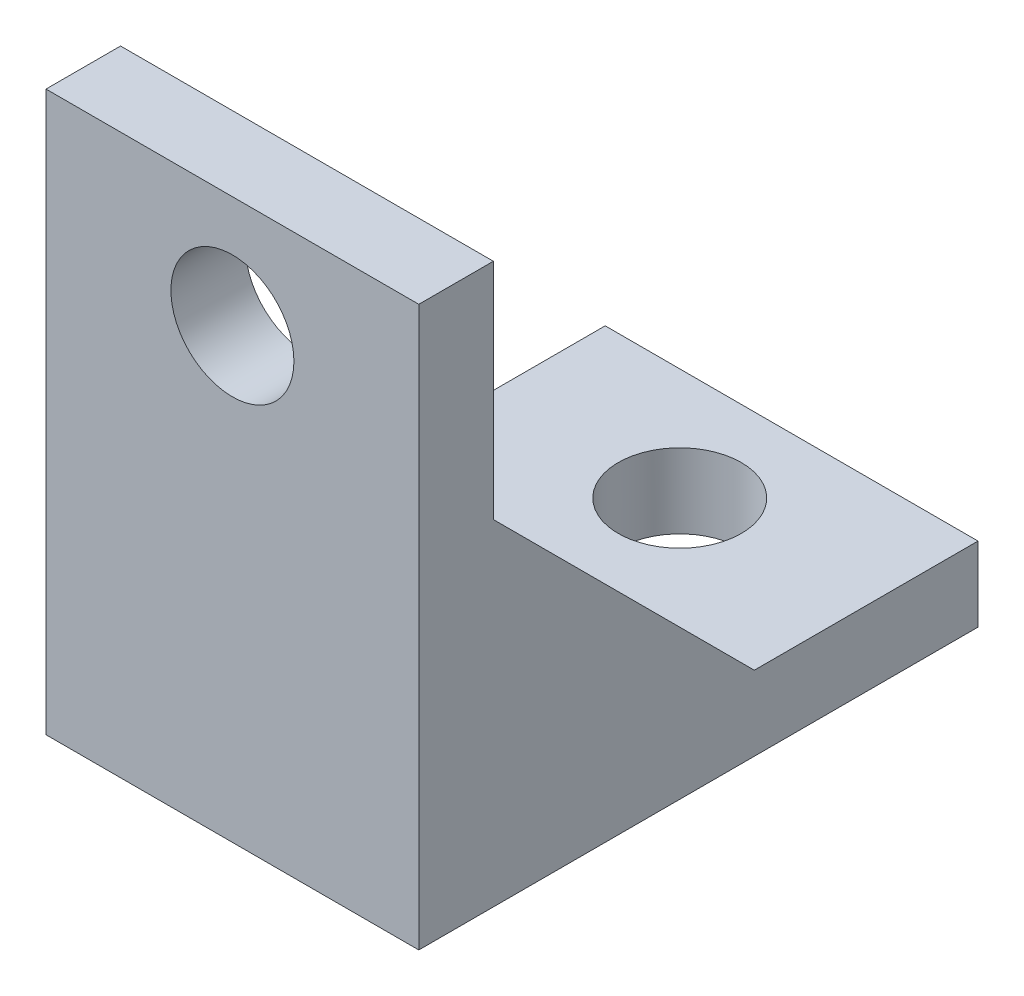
SolidWorks part; units mm, degrees
ref_plane "Alzado" through (0, 0, 0) normal (0, 0, 1) x (1, 0, 0)
ref_plane "Planta" through (0, 0, 0) normal (0, 1, 0) x (1, 0, 0)
ref_plane "Vista lateral" through (0, 0, 0) normal (1, 0, 0) x (0, 0, -1)
sketch "Croquis1" plane through (0, 0, 0) normal (1, 0, 0) x (0, 0, -1)
  line L0 (0, 0) -> (0, 15)
  line L1 (0, 15) -> (2, 15)
  line L2 (2, 15) -> (2, 2)
  line L3 (2, 2) -> (15, 2)
  line L4 (15, 2) -> (15, 0)
  line L5 (15, 0) -> (0, 0)
  dimension "D1" = 15
  dimension "D2" = 15
  dimension "D3" = 2
  dimension "D4" = 2
extrude "Saliente-Extruir1" add sketch "Croquis1" along normal blind 10
sketch "Croquis2" plane through (0, 0, 0) normal (0, 1, 0) x (1, 0, 0)
  line L0 (10, 15) -> (0, 15) construction
  circle A0 centre (5, 12) radius 1.65
  point P5 (5, 15)
  dimension "D1" = 3.3
  dimension "D2" = 3
extrude "Cortar-Extruir1" cut sketch "Croquis2" along normal through all and the other way through all
sketch "Croquis3" plane through (0, 0, 0) normal (0, 0, 1) x (1, 0, 0)
  line L0 (10, 15) -> (0, 15) construction
  circle A0 centre (5, 12) radius 1.65
  point P5 (5, 15)
  dimension "D1" = 3.3
  dimension "D2" = 3
extrude "Cortar-Extruir2" cut sketch "Croquis3" against normal through all
sketch "Croquis4" plane through (0, 0, 0) normal (1, 0, 0) x (0, 0, -1)
  line L0 (2, 9) -> (9, 2)
  line L1 (2, 2) -> (2, 15) construction
  line L2 (15, 2) -> (2, 2) construction
  dimension "D1" = 6
  dimension "D2" = 6
rib "Nervio1" sketch "Croquis4" sketch "Croquis4" thickness 10 parameters "D1"=10
